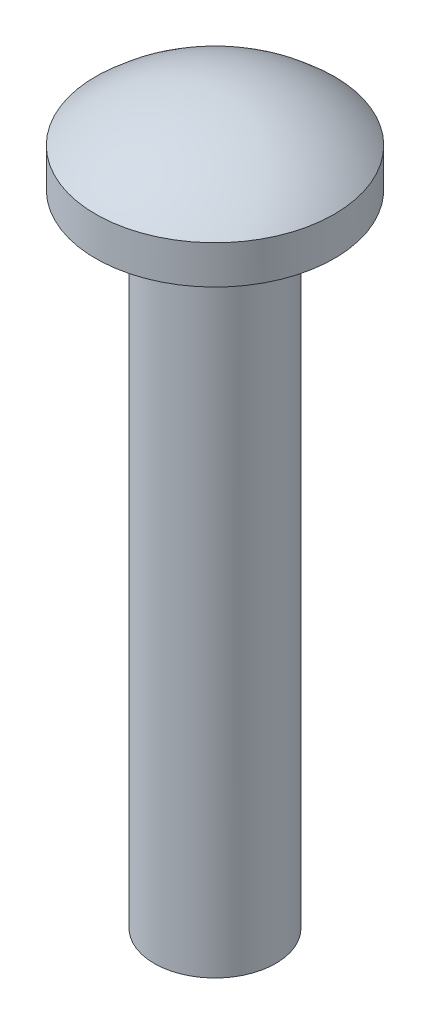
SolidWorks part; units mm, degrees
ref_plane "Front Plane" through (0, 0, 0) normal (0, 0, 1) x (1, 0, 0)
ref_plane "Top Plane" through (0, 0, 0) normal (0, 1, 0) x (1, 0, 0)
ref_plane "Right Plane" through (0, 0, 0) normal (1, 0, 0) x (0, 0, -1)
sketch "Sketch1" plane through (0, 0, 0) normal (0, 0, 1) x (1, 0, 0)
  line L0 (0, 0) -> (0, 3.3782)
  line L1 (0, 0) -> (4.7371, 0)
  line L2 (4.7371, 0) -> (4.7371, 1.524)
  line L3 (0, 3.3782) -> (-1.0583, 3.3782) construction
  arc A0 (0, 3.3782) -> (4.7371, 1.524) centre (0, -3.6001) cw
  dimension "D1" = 4.7371
  dimension "D2" = 3.3782
  dimension "D3" = 1.524
revolve "Revolve1" add sketch "Sketch1" angle 360 about L0
sketch "Sketch2" plane through (0, 0, 0) normal (0, 1, 0) x (1, 0, 0)
  circle A0 centre (0, 0) radius 2.413
  dimension "D1" = 4.826
extrude "Boss-Extrude1" add sketch "Sketch2" against normal blind 25.4
